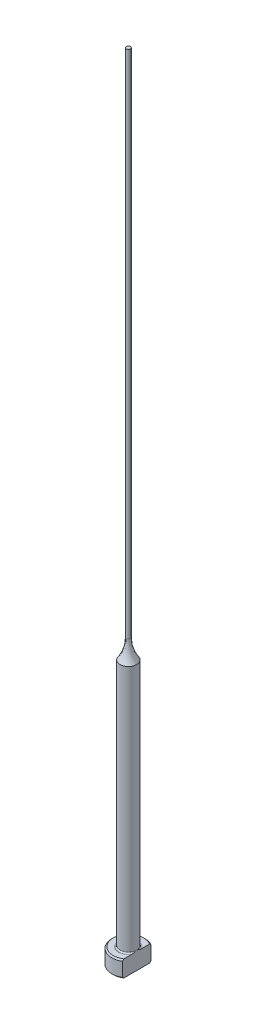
SolidWorks part; units mm, degrees
ref_plane "Front Plane" through (0, 0, 0) normal (0, 0, 1) x (1, 0, 0)
ref_plane "Top Plane" through (0, 0, 0) normal (0, 1, 0) x (1, 0, 0)
ref_plane "Right Plane" through (0, 0, 0) normal (1, 0, 0) x (0, 0, -1)
sketch "Sketch1" plane through (0, 0, 0) normal (0, 0, 1) x (1, 0, 0)
  line L0 (0, 259.9588) -> (0, -15.1925) construction
  line L1 (0, 0) -> (-3.175, 0)
  line L2 (-3.175, 0) -> (-3.175, 3.175)
  line L3 (-3.175, 3.175) -> (-1.5875, 3.175)
  line L4 (-0.3962, 54.5027) -> (-0.3962, 152.4)
  line L5 (-0.3962, 152.4) -> (0, 152.4)
  line L6 (0, 152.4) -> (0, 0)
  line L7 (-1.5875, 3.175) -> (-1.5875, 50.8)
  arc A0 (-1.5875, 50.8) -> (-0.3962, 54.5027) centre (-6.7462, 54.5027) ccw
  point P13 (-1.5875, 0)
  dimension "D1" = 6.35
  dimension "L" = 152.4
  dimension "D2" = 3.175
  dimension "H" = 6.35
  dimension "T" = 3.175
  dimension "D" = 0.7925
  dimension "S" = 50.8
revolve "Revolve1" add sketch "Sketch1" angle 360 about L0
chamfer "Chamfer1" distance 0.254 angle 45 2 edges at (0, 3.175, 3.175) (0, 0, 3.175)
fillet "Fillet1" radius 0.254 1 edges at (0, 3.175, 1.5875)
sketch "Sketch2" plane through (0, 0, 0) normal (0, 1, 0) x (1, 0, 0)
  line L0 (1.5875, -2.7496) -> (1.5875, 2.7496)
  circle A0 centre (0, 0) radius 3.175 construction
  arc A2 (1.5875, -2.7496) -> (1.5875, 2.7496) centre (0, 0) ccw
  circle A3 centre (0, 0) radius 3.175 construction
  circle A4 centre (0, 0) radius 1.5875 construction
extrude "Key Head" cut sketch "Sketch2" along normal up to next
